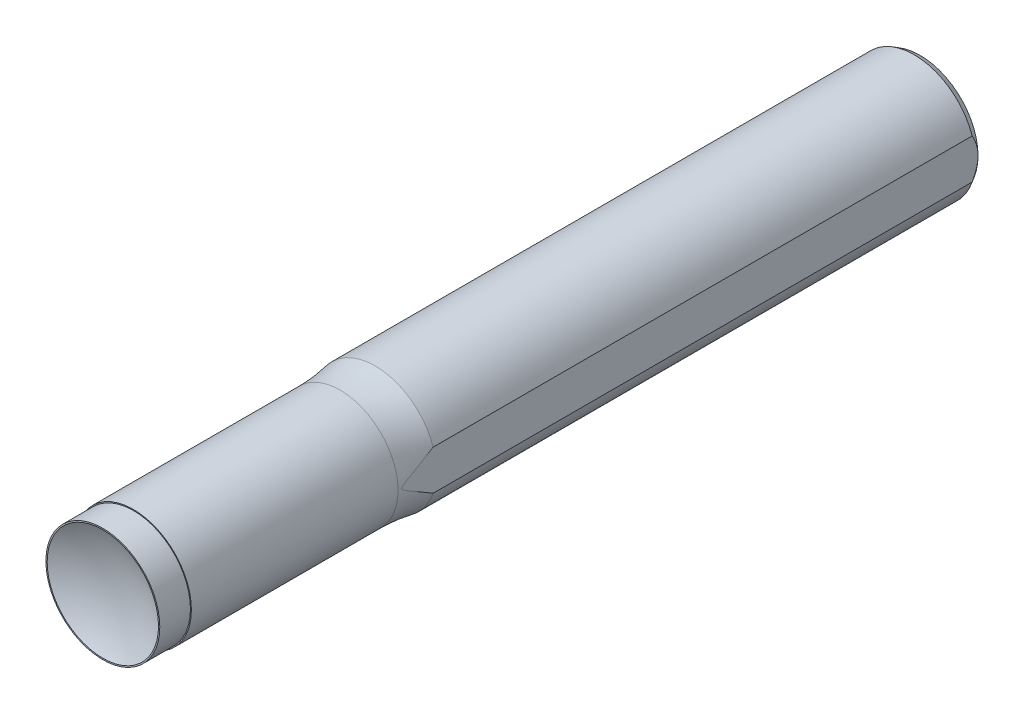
SolidWorks part; units mm, degrees
ref_plane "Front Plane" through (0, 0, 0) normal (0, 0, 1) x (1, 0, 0)
ref_plane "Top Plane" through (0, 0, 0) normal (0, 1, 0) x (1, 0, 0)
ref_plane "Right Plane" through (0, 0, 0) normal (1, 0, 0) x (0, 0, -1)
sketch "Sketch1" plane through (0, 0, 0) normal (0, 0, 1) x (1, 0, 0)
  circle A0 centre (0, 0) radius 9.525
  dimension "D1" = 19.05
extrude "Boss-Extrude1" add sketch "Sketch1" against normal blind 127
sketch "Sketch2" plane through (0, 0, 0) normal (0, 0, 1) x (1, 0, 0)
  circle A0 centre (0, 0) radius 9
  dimension "D1" = 18
extrude "Cut-Extrude1" cut sketch "Sketch2" against normal blind 42.3333 flip side to cut
sketch "Sketch3" plane through (0, 0, 0) normal (0, 0, 1) x (1, 0, 0)
  circle A0 centre (0, 0) radius 8.85
  dimension "D1" = 17.7
extrude "Cut-Extrude2" cut sketch "Sketch3" against normal blind 4.7625 flip side to cut
sketch "Sketch4" plane through (0, 0, 0) normal (1, 0, 0) x (0, 0, -1)
  line L0 (0, 0) -> (0, 8.65)
  line L1 (0, 8.85) -> (0, -8.85) construction
  line L2 (2.0771, 0) -> (2.0771, 8.65) construction
  line L3 (0, 0) -> (2.0771, 0)
  line L4 (0, 0) -> (0, -8.65) construction
  arc A0 (2.0771, 0) -> (0, 8.65) centre (-16.9729, 0) ccw
  dimension "D2" = 19.05
  dimension "D1" = 17.3
revolve "Cut-Revolve1" cut sketch "Sketch4" angle 360 about L3
chamfer "Chamfer1" distance 0.9 angle 30 1 edges at (9.525, 0, -127)
sketch "Sketch5" plane through (0, 0, 0) normal (1, 0, 0) x (0, 0, -1)
  line L0 (42.3333, 0) -> (36.881, 0)
  line L1 (42.3333, 9.525) -> (42.3333, -9.525) construction
  line L2 (36.881, 0) -> (36.881, 9)
  line L3 (42.3333, 9) -> (4.7625, 9) construction
  line L4 (42.3333, 9.525) -> (42.3333, 0)
  line L5 (36.881, 9) -> (42.3333, 9) construction
  arc A0 (36.881, 9) -> (42.3333, 9.525) centre (36.881, 37.575) ccw
  dimension "D1" = 28.575
revolve "Revolve1" add sketch "Sketch5" angle 360 about L0
sketch "Sketch6" plane through (0, 0, 0) normal (1, 0, 0) x (0, 0, -1)
  line L0 (84.6667, 0) -> (108.4867, 0)
  line L1 (84.6667, 0) -> (84.6667, 19.05)
  line L2 (84.6667, 19.05) -> (91.9889, 19.05)
  line L3 (108.4867, 0) -> (108.4867, 9.525)
  line L4 (126.1, 9.525) -> (42.3333, 9.525) construction
  line L5 (108.4867, 9.525) -> (84.6667, 9.525) construction
  line L6 (127, -9.525) -> (127, 9.525) construction
  arc A0 (108.4867, 9.525) -> (91.9889, 19.05) centre (108.4867, 28.575) cw
  dimension "D2" = 19.05
  dimension "D1" = 42.3333
  dimension "D3" = 23.82
revolve "Revolve2" [suppressed] add sketch "Sketch6" angle 360 about L0
sketch "Sketch7" plane through (0, 0, -127) normal (0, 0, -1) x (-1, 0, 0)
  line L9 (-15.2114, 3.103) -> (-9.0054, 3.103)
  line L10 (-15.2114, 3.103) -> (-15.2114, -3.103)
  line L11 (-15.2114, -3.103) -> (-9.0054, -3.103)
  line L12 (-9.0054, 3.103) -> (-9.0054, -3.103)
  circle A5 centre (0, 0) radius 9.525 construction
  circle A6 centre (0, 0) radius 9.0054 construction
  point P8 (-9.0054, 0)
extrude "Cut-Extrude3" cut sketch "Sketch7" against normal through all
